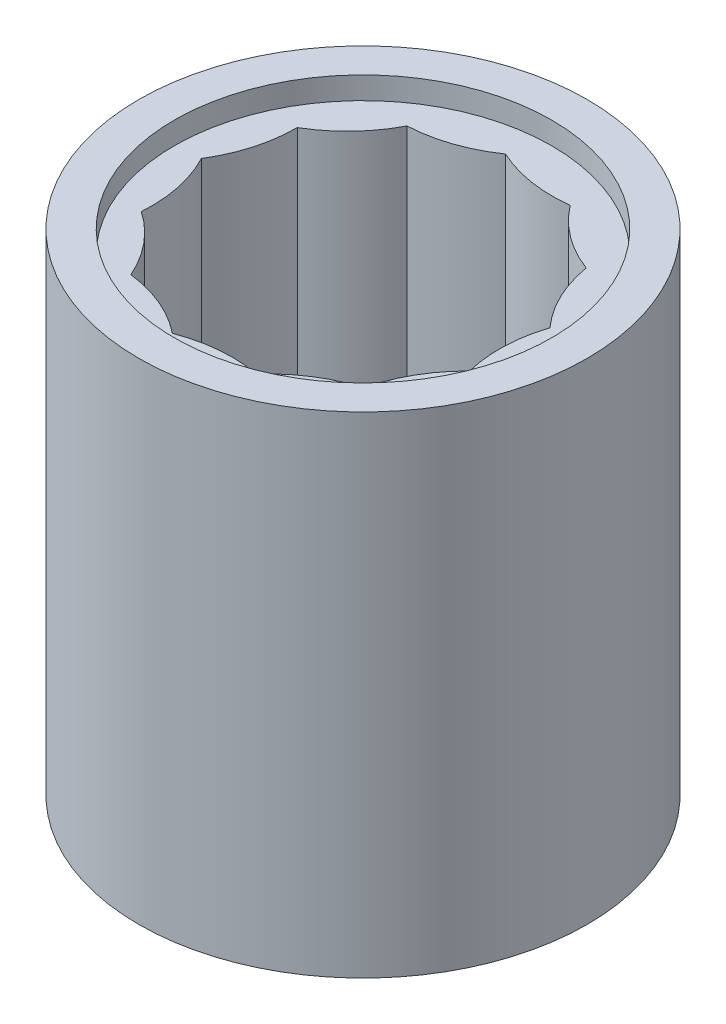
SolidWorks part; units mm, degrees
ref_plane "Front Plane" through (0, 0, 0) normal (0, 0, 1) x (1, 0, 0)
ref_plane "Top Plane" through (0, 0, 0) normal (0, 1, 0) x (1, 0, 0)
ref_plane "Right Plane" through (0, 0, 0) normal (1, 0, 0) x (0, 0, -1)
other "Center of Mass"
sketch "Sketch1" plane through (0, 0, 0) normal (0, 1, 0) x (1, 0, 0)
  line L0 (0, 0) -> (-21.4564, 15.9439)
  arc A0 (0, 0) -> (-21.4564, 15.9439) centre (-2.7563, 18.7002) cw
extrude "Boss-Extrude1" add sketch "Sketch1" along normal blind 60
sketch "Sketch2" plane through (0, 0, 0) normal (0, 1, 0) x (1, 0, 0)
  circle A0 centre (-22.4433, -7.7936) radius 23.758
pattern_curve "CrvPattern2" of "Boss-Extrude1" parameters "D1"=13, "D3"=10, "D2"=1, "D4"=10
ref_plane "Plane1" through (0, -3, 0) normal (0, -1, 0) x (-1, 0, 0)
sketch "Sketch4" plane through (0, -3, 0) normal (0, -1, 0) x (-1, 0, 0)
  circle A0 centre (25.9687, -12.4712) radius 30.1808
  circle A1 centre (25.9687, -12.4712) radius 25.3972
extrude "Boss-Extrude2" add sketch "Sketch4" against normal blind 66
scale "Scale1" scale about centroid uniform scaling yes scale factor 1.8
